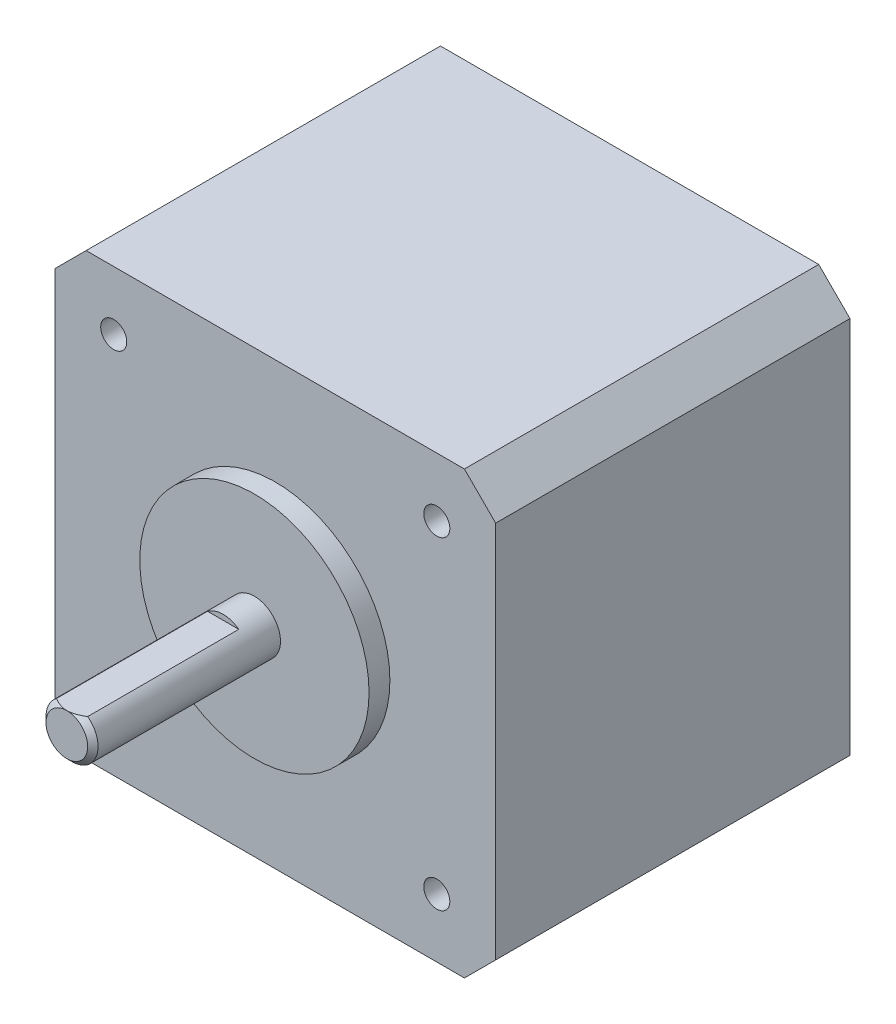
SolidWorks part; units mm, degrees
ref_plane "前视基准面" through (0, 0, 0) normal (0, 0, 1) x (1, 0, 0)
ref_plane "上视基准面" through (0, 0, 0) normal (0, 1, 0) x (1, 0, 0)
ref_plane "右视基准面" through (0, 0, 0) normal (1, 0, 0) x (0, 0, -1)
sketch "草图1" plane through (0, 0, 0) normal (0, 0, 1) x (1, 0, 0)
  circle A0 centre (0, 0) radius 11
extrude "凸台-拉伸1" add sketch "草图1" against normal blind 2
sketch "草图2" plane through (0, 0, 0) normal (0, 0, 1) x (1, 0, 0)
  circle A0 centre (0, 0) radius 2.5
extrude "凸台-拉伸2" add sketch "草图2" along normal blind 18
sketch "草图3" plane through (0, 0, 18) normal (0, 0, 1) x (1, 0, 0)
  line L1 (0, 2) -> (2.8558, 2)
  line L2 (2.8558, 2) -> (2.8558, 3.4127)
  line L3 (2.8558, 3.4127) -> (-2.5, 3.4127)
  line L4 (-2.5, 3.4127) -> (-2.5, 2)
  line L5 (-2.5, 2) -> (0, 2)
extrude "切除-拉伸1" cut sketch "草图3" against normal blind 15
chamfer "倒角1" distance 0.5 angle 45 1 edges at (0, -2.5, 18)
sketch "草图4" plane through (0, 0, -2) normal (0, 0, -1) x (-1, 0, 0)
  line L0 (-21.15, 18.15) -> (-18.15, 21.15)
  line L1 (0, 21.15) -> (18.15, 21.15)
  line L2 (21.15, 18.15) -> (21.15, -18.15)
  line L3 (18.15, -21.15) -> (-18.15, -21.15)
  line L4 (-21.15, -18.15) -> (-21.15, 18.15)
  line L5 (-18.15, 21.15) -> (0, 21.15)
  line L6 (18.15, 21.15) -> (21.15, 18.15)
  line L7 (21.15, -18.15) -> (18.15, -21.15)
  line L8 (-18.15, -21.15) -> (-21.15, -18.15)
  point P3 (21.15, 21.15)
  point P4 (21.15, -21.15)
  point P5 (-21.15, -21.15)
  point P6 (-21.15, 21.15)
extrude "凸台-拉伸3" add sketch "草图4" along normal blind 34
sketch "草图5" plane through (0, 0, -2) normal (0, 0, 1) x (1, 0, 0)
  point P8 (-15.5, 15.5)
  point P9 (15.5, 15.5)
  point P10 (15.5, -15.5)
  point P11 (-15.5, -15.5)
hole_wizard "M3 螺纹孔1" positions "草图7" profile "草图6" tap size "M3" standard "GB"
sketch "草图7" plane through (0, 0, -2) normal (0, 0, 1) x (1, 0, 0)
  point P0 (-15.5, 15.5)
  point P3 (15.5, 15.5)
  point P6 (15.5, -15.5)
  point P9 (-15.5, -15.5)
sketch "草图6" plane through (-15.5, 15.5, -2) normal (1, 0, 0) x (0, -1, 0)
  line L0 (0, 0) -> (0, 7.7511)
  line L1 (0, 7.7511) -> (1.25, 7)
  line L2 (1.25, 7) -> (1.25, 0)
  line L5 (1.25, 0) -> (0, 0)
  line L10 (0, 7.7511) -> (-1.25, 7) construction
  line L11 (0, -6.35) -> (0, 107.95) construction
  dimension "螺纹孔钻头直径" = 2.5
  dimension "螺纹孔钻头深度" = 7
  dimension "导头角度" = 118
